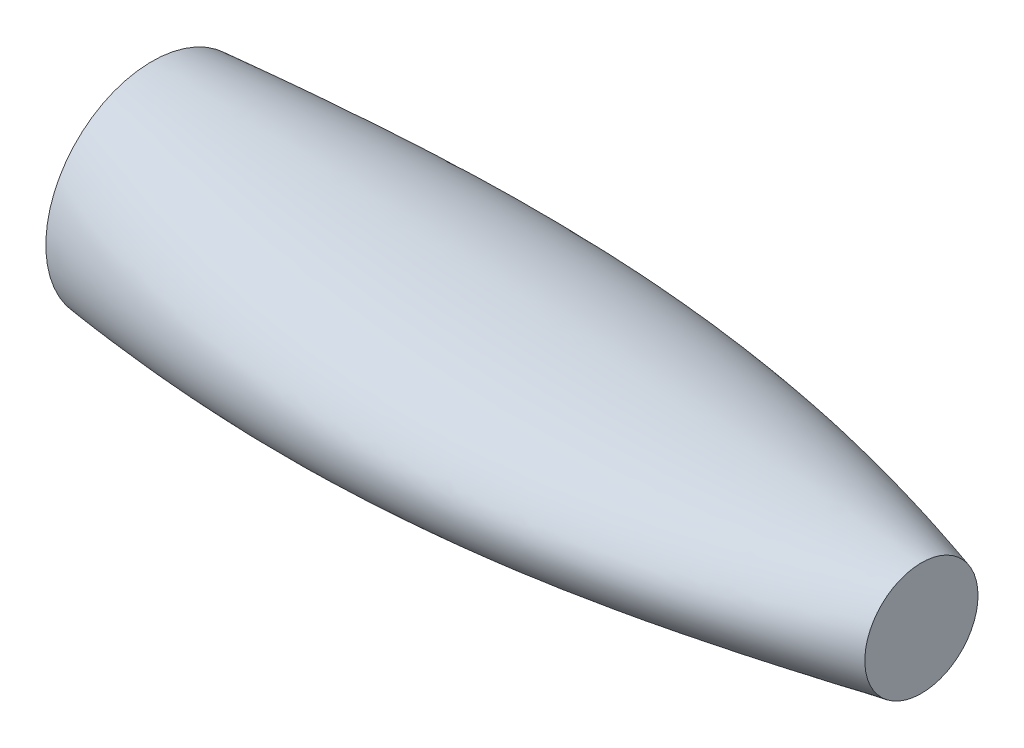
SolidWorks part; units mm, degrees
ref_plane "Ebene vorne" through (0, 0, 0) normal (0, 0, 1) x (1, 0, 0)
ref_plane "Ebene oben" through (0, 0, 0) normal (0, 1, 0) x (1, 0, 0)
ref_plane "Ebene rechts" through (0, 0, 0) normal (1, 0, 0) x (0, 0, -1)
sketch "Skizze1" plane through (0, 0, 0) normal (1, 0, 0) x (0, 0, -1)
  circle A0 centre (0, 0) radius 41.3732
ref_plane "Ebene1" through (300, 0, 0) normal (1, 0, 0) x (0, 0, -1)
sketch "Skizze2" plane through (300, 0, 0) normal (1, 0, 0) x (0, 0, -1)
  circle A0 centre (0, 0) radius 22.0676
sketch "Skizze4" plane through (0, 0, 0) normal (0, 1, 0) x (1, 0, 0)
  line L0 (0, -41.3732) -> (0, 41.3732) construction
  line L1 (300, -22.0676) -> (300, 22.0676) construction
  line L2 (-1000, 0) -> (49000, 0) construction
  spline S0 degree 2 poles (0, 41.3732) (151.5716, 79.9364) (300, 22.0676) knots 0 0 0 1 1 1
  spline S1 degree 2 poles (0, -41.3732) (151.5716, -79.9364) (300, -22.0676) knots 0 0 0 1 1 1
loft "Ausformung1" add profiles "Skizze1", "Skizze2"
